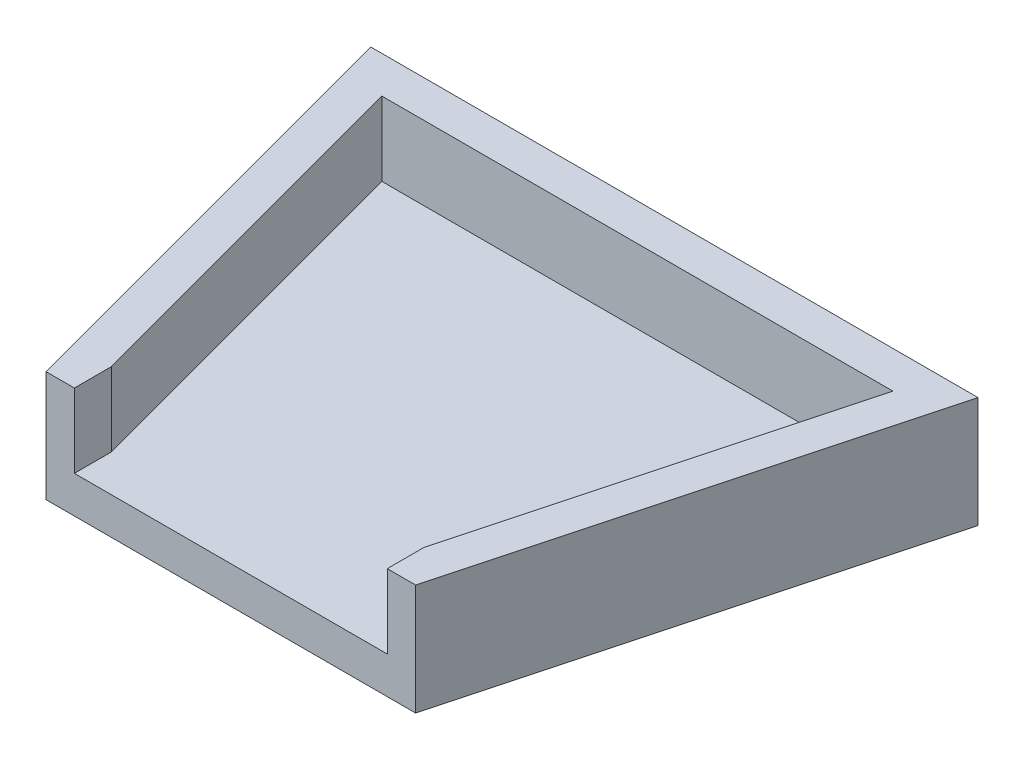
SolidWorks part; units mm, degrees
ref_plane "Front Plane" through (0, 0, 0) normal (0, 0, 1) x (1, 0, 0)
ref_plane "Top Plane" through (0, 0, 0) normal (0, 1, 0) x (1, 0, 0)
ref_plane "Right Plane" through (0, 0, 0) normal (1, 0, 0) x (0, 0, -1)
sketch "Sketch1" plane through (0, 0, 0) normal (0, 1, 0) x (1, 0, 0)
  line L0 (-50, -60) -> (-82.1539, 60)
  line L1 (-50, 60) -> (50, 60)
  line L2 (-50, 60) -> (-50, -60)
  line L3 (-50, -60) -> (50, -60)
  line L4 (50, 60) -> (50, -60)
  line L5 (-50, 60) -> (50, -60) construction
  line L6 (-50, -60) -> (50, 60) construction
  line L7 (50, -60) -> (82.1539, 60)
  line L8 (82.1539, 60) -> (-82.1539, 60)
  point P0 (0, 0)
  point P6 (0, 0)
  dimension "D1" = 100
  dimension "D2" = 120
  dimension "D3" = 15
extrude "Boss-Extrude1" add sketch "Sketch1" along normal blind 30 contours L2 L8 L0 | L4 L1 L2 L3 | L7 L8 L4
shell "Shell1" thickness 10
sketch "Sketch2" plane through (0, 30, 0) normal (0, 1, 0) x (1, 0, 0)
  line L0 (-42.3267, -50) -> (-42.3267, -60)
  line L1 (-50, -60) -> (50, -60) construction
  line L2 (42.3267, -50) -> (42.3267, -60)
  line L3 (42.3267, -60) -> (-42.3267, -60)
  line L4 (-42.3267, -50) -> (42.3267, -50)
extrude "Cut-Extrude1" cut sketch "Sketch2" against normal up to surface (20 mm away)
